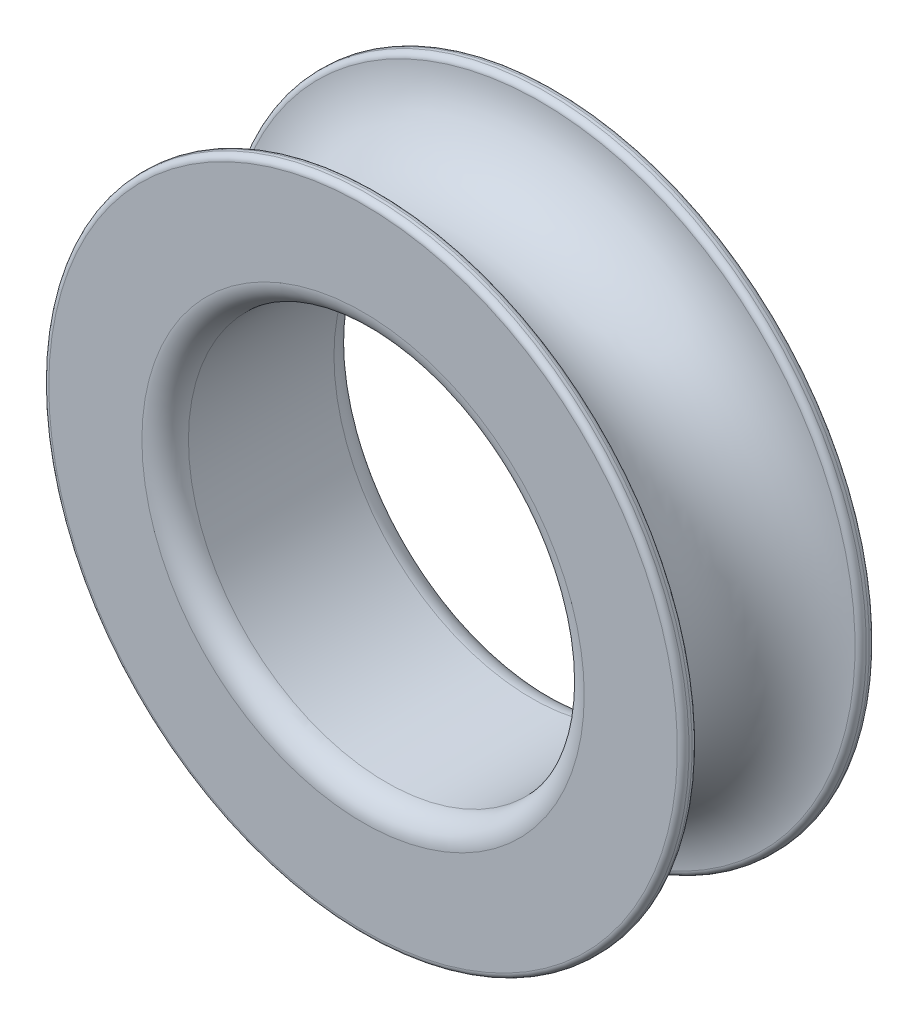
SolidWorks part; units mm, degrees
ref_plane "Front Plane" through (0, 0, 0) normal (0, 0, 1) x (1, 0, 0)
ref_plane "Top Plane" through (0, 0, 0) normal (0, 1, 0) x (1, 0, 0)
ref_plane "Right Plane" through (0, 0, 0) normal (1, 0, 0) x (0, 0, -1)
ref_plane "Plane1" through (0, 0, 0) normal (0, -1, 0) x (1, 0, 0)
sketch "Sketch1" plane through (0, 0, 0) normal (0, -1, 0) x (1, 0, 0)
  line L0 (27.5, -7.75) -> (27.5, -7.4833)
  line L1 (27.5, 7.4833) -> (27.5, 7.75)
  line L2 (27, 8.25) -> (19, 8.25)
  line L3 (17, 6.25) -> (17, -6.25)
  line L4 (19, -8.25) -> (27, -8.25)
  line L5 (0, 8.84) -> (0, -7.66) construction
  line L6 (0, 0) -> (17, 0) construction
  arc A0 (27.5, -7.4833) -> (27.0333, -6.9844) centre (27, -7.4833) ccw
  arc A1 (27.0333, -6.9844) -> (27.0333, 6.9844) centre (27.5, 0) cw
  arc A2 (27.0333, 6.9844) -> (27.5, 7.4833) centre (27, 7.4833) ccw
  arc A3 (27.5, 7.75) -> (27, 8.25) centre (27, 7.75) ccw
  arc A4 (19, 8.25) -> (17, 6.25) centre (19, 6.25) ccw
  arc A5 (17, -6.25) -> (19, -8.25) centre (19, -6.25) ccw
  arc A6 (27, -8.25) -> (27.5, -7.75) centre (27, -7.75) ccw
  dimension "D2" = 2
  dimension "D3" = 2
  dimension "D4" = 7
  dimension "D6" = 0.5
  dimension "D7" = 0.5
  dimension "D11" = 0.5
  dimension "D12" = 0.5
  dimension "D1" = 17
  dimension "D5" = 8
  dimension "D8" = 0.2667
  dimension "D9" = 12.5
  dimension "D10" = 6.25
  dimension "D13" = 0.2667
revolve "Revolve1" add sketch "Sketch1" angle 360 about L5
